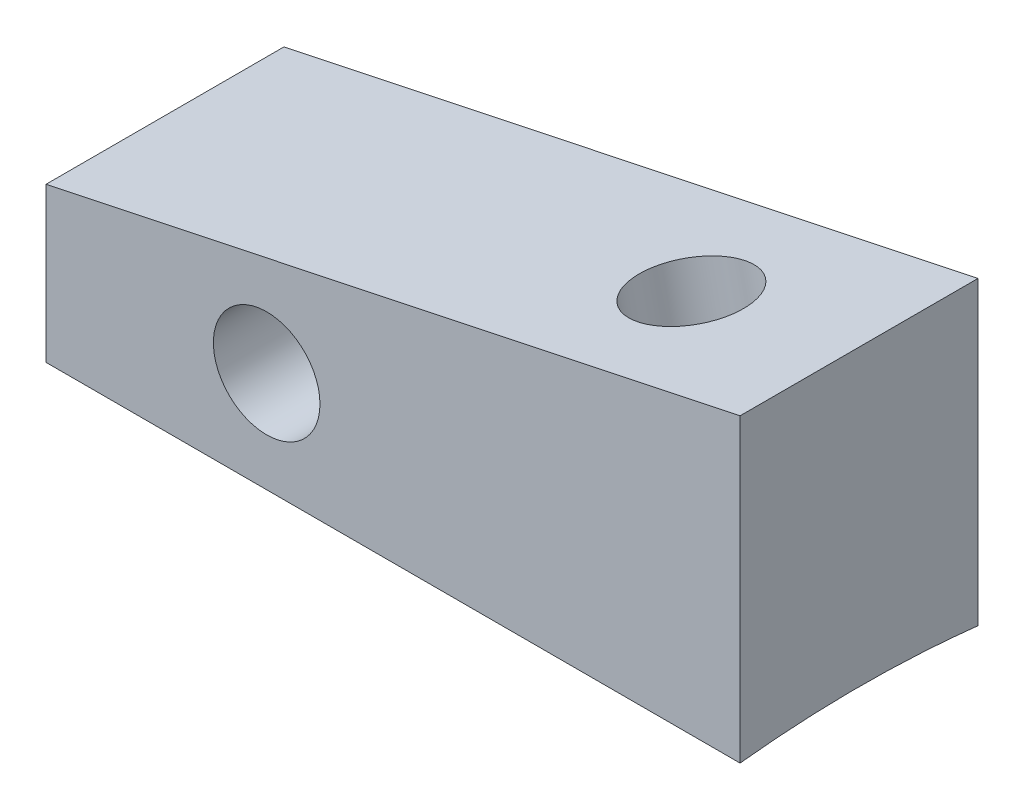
SolidWorks part; units mm, degrees
ref_plane "Front" through (0, 0, 0) normal (0, 0, 1) x (1, 0, 0)
ref_plane "Top" through (0, 0, 0) normal (0, 1, 0) x (1, 0, 0)
ref_plane "Right" through (0, 0, 0) normal (1, 0, 0) x (0, 0, -1)
sketch "Sketch1" plane through (0, 0, 0) normal (0, 0, 1) x (1, 0, 0)
  line L0 (-18.5226, 4.1168) -> (-18.5226, 0)
  line L1 (-18.5226, 0) -> (0, 0)
  line L2 (0, 0) -> (-0.0007, 8.0264)
  line L3 (-0.0007, 8.0264) -> (-18.5226, 4.1168)
  dimension "D1" = 11.919
  dimension "D2" = 18.5226
  dimension "D3" = 8.0264
extrude "Extrude1" add sketch "Sketch1" along normal blind 6.35
sketch "Sketch2" plane through (0, 0, 6.35) normal (0, 0, 1) x (1, 0, 0)
  line L0 (-0.0007, 8.0264) -> (-0.0007, 0) construction
  line L1 (-18.5226, 0) -> (0, 0) construction
  line L2 (-0.0007, 4.0132) -> (-18.5226, 4.0132) construction
  line L3 (-18.5226, 4.1168) -> (-18.5226, 0) construction
  line L4 (-0.0007, 4.0132) -> (-18.5226, 2.0584) construction
hole_wizard "#4-40 Tapped Hole2" positions "3DSketch2" profile "Sketch10" tap size "#4-40" standard "Ansi Inch"
sketch3d "3DSketch2"
  line L3 (-0.0007, 8.0264, 3.175) -> (-18.5226, 4.1168, 3.175) construction
  line L4 (-0.0007, 8.0264, 6.35) -> (-0.0007, 8.0264, 0) construction
  line L5 (-18.5226, 4.1168, 6.35) -> (-18.5226, 4.1168, 0) construction
  point P10 (-4.4741, 7.0822, 3.175)
  point P12 (-4.4741, 7.0822, 3.175)
  dimension "D1" = 4.572
sketch "Sketch10" plane through (-4.4741, 7.0822, 3.175) normal (0, 0, 1) x (-0.9784, -0.2065, 0)
  line L0 (0, 0) -> (0, 7.8535)
  line L1 (0, 7.8535) -> (1.4224, 7.8535)
  line L2 (1.4224, 7.8535) -> (1.4224, 0)
  line L5 (1.4224, 0) -> (0, 0)
  line L11 (0, -6.35) -> (0, 107.95) construction
  dimension "Thread Major Dia." = 2.8448
  dimension "Thru Tap Drill Depth" = 7.8535
hole_wizard "#4-40 Tapped Hole1" positions "3DSketch1" profile "Sketch4" tap size "#4-40" standard "Ansi Inch"
sketch3d "3DSketch1"
  line L2 (-4.4741, 7.0822, 6.35) -> (-2.9792, 0, 6.35) construction
  line L3 (-0.0007, 8.0264, 6.35) -> (-18.5226, 4.1168, 6.35) construction
  line L4 (-18.5226, 0, 6.35) -> (0, 0, 6.35) construction
  point P4 (-12.6334, 2.6924, 6.35)
  point P28 (-12.6334, 2.6924, 6.35)
  dimension "D1" = 4.572
  dimension "D2" = 8.89
  dimension "D3" = 2.6924
sketch "Sketch4" plane through (-12.6334, 2.6924, 6.35) normal (1, 0, 0) x (0, -1, 0)
  line L0 (0, 0) -> (0, 6.35)
  line L1 (0, 6.35) -> (1.4224, 6.35)
  line L2 (1.4224, 6.35) -> (1.4224, 0)
  line L5 (1.4224, 0) -> (0, 0)
  line L11 (0, -6.35) -> (0, 107.95) construction
  dimension "Thread Major Dia." = 2.8448
  dimension "Thru Tap Drill Depth" = 6.35
sketch "Sketch5" plane through (-18.5226, 0, 0) normal (-1, 0, 0) x (0, 0, 1)
  line L0 (0, 0) -> (0, -0.3525)
  line L1 (0, -0.3525) -> (6.35, -0.3525)
  line L2 (6.35, -0.3525) -> (6.35, 0)
  arc A0 (0, 0) -> (6.35, 0) centre (3.175, -28.3981) cw
  dimension "D1" = 28.575
extrude "Cut-Extrude1" cut sketch "Sketch5" against normal through all
sketch "Sketch7" plane through (0, 0, 6.35) normal (0, 0, 1) x (1, 0, 0)
  line L0 (-12.5621, 2.691) -> (-4.0101, 3.5935) construction
  line L1 (-18.5226, 0) -> (0, 0) construction
  point P0 (-4.0101, 3.5935)
  point P1 (-12.5621, 2.691)
  dimension "D1" = 6.025
sketch "Sketch8" plane through (0, 0, 0) normal (1, 0.0001, 0) x (0, 0, -1)
  line L0 (-3.175, 6.4675) -> (-3.175, 0.1769) construction
  line L1 (0, 6.4675) -> (-6.35, 6.4675) construction
  line L2 (-3.175, -28.3976) -> (-3.175, -28.3966) construction
  arc A0 (0, 0) -> (-6.35, 0) centre (-3.175, -28.3981) ccw construction
  dimension "D1" = 3.4169
  dimension "D2" = 2.5151
